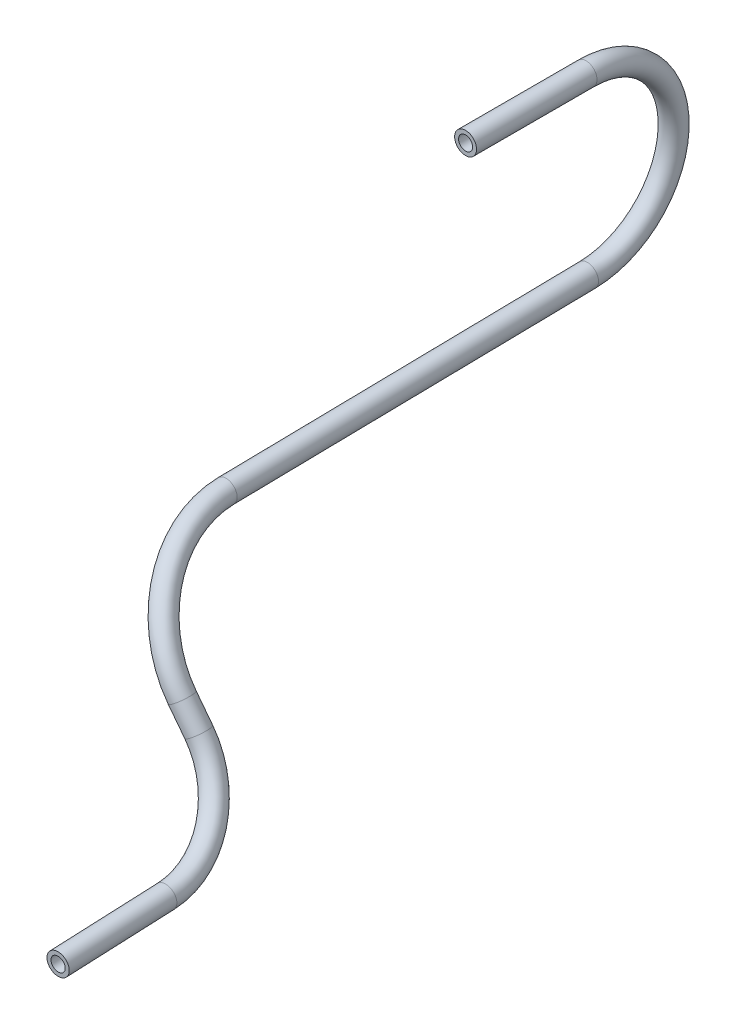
SolidWorks part; units mm, degrees
ref_plane "Front Plane" through (0, 0, 0) normal (0, 0, 1) x (1, 0, 0)
ref_plane "Top Plane" through (0, 0, 0) normal (0, 1, 0) x (1, 0, 0)
ref_plane "Right Plane" through (0, 0, 0) normal (1, 0, 0) x (0, 0, -1)
sketch "Sketch1" plane through (0, 0, 0) normal (1, 0, 0) x (0, 0, -1)
  line L3 (17.6841, -25.3981) -> (-34.6954, -26.3124)
  line L4 (17.4625, 0) -> (0, 0)
  arc A2 (17.6841, -25.3981) -> (17.4625, 0) centre (17.4625, -12.7) ccw
  dimension "D1" = 12.7
  dimension "D2" = 1
  dimension "D5" = 52.3875
  dimension "D7" = 17.4625
sketch "Sketch2" plane through (0, 0, 0) normal (0, 0, 1) x (1, 0, 0)
  circle A0 centre (0, 0) radius 1.5875
  circle A1 centre (0, 0) radius 1.016
  dimension "D1" = 3.175
  dimension "D2" = 2.032
sweep "Sweep2" add profiles "Sketch2" path "Sketch1"
ref_plane "Plane2" through (0, -25.6989, -0.4486) normal (0, -0.9998, -0.0175) x (-0.0175, 0.0174, -0.9997)
sketch "Sketch5" plane through (0, -0.6134, 35.144) normal (0, -0.0175, 0.9998) x (1, 0, 0)
  line L0 (1.2609, -44.1997) -> (21.3128, -30.1592) construction
  line L1 (0, -25.7028) -> (0, -13.3682) construction
  circle A0 centre (0, -25.7028) radius 1.016
  circle A1 centre (0, -25.7028) radius 1.5875
  dimension "D1" = 125
  dimension "D2" = 15.875
revolve "Revolve1" add sketch "Sketch5" angle 91 about L0
sketch "Sketch6" plane through (20.8237, -29.7237, -1.1526) normal (0.5735, -0.8186, -0.0317) x (0.6422, 0.4733, -0.603)
  circle A0 centre (-43.2456, 31.8791) radius 1.016 construction
  circle A1 centre (-43.2456, 31.8791) radius 1.5875
  circle A2 centre (-43.2456, 31.8791) radius 1.5875
  circle A3 centre (-43.2456, 31.8791) radius 1.016
  dimension "D1" = 0
extrude "Boss-Extrude1" add sketch "Sketch6" along normal blind 3.9687
sketch "Sketch7" plane through (23.0997, -32.9725, -1.2786) normal (0.5735, -0.8186, -0.0317) x (-0.0311, 0.0169, -0.9994)
  line L0 (-63.923, -18.6454) -> (-63.5841, -38.0587) construction
  line L1 (-51.266, -16.0702) -> (-51.266, -27.9924) construction
  circle A0 centre (-51.266, -16.0702) radius 1.016 construction
  circle A1 centre (-51.266, -16.0702) radius 1.5875
  circle A2 centre (-51.266, -16.0702) radius 1.5875
  circle A3 centre (-51.266, -16.0702) radius 1.016
  dimension "D2" = 1
  dimension "D3" = 12.7
  dimension "D1" = 0
revolve "Revolve2" add sketch "Sketch7" angle 90 about L0
sketch "Sketch8" plane through (1.082, -1.7318, 64.2062) normal (0.0168, -0.027, 0.9995) x (0.9999, 0.0004, -0.0168)
  circle A0 centre (17.9585, -52.101) radius 1.016 construction
  circle A1 centre (17.9585, -52.101) radius 1.5875
  circle A2 centre (17.9585, -52.101) radius 1.5875
  circle A3 centre (17.9585, -52.101) radius 1.016
  dimension "D1" = 0
extrude "Boss-Extrude2" add sketch "Sketch8" along normal blind 15.875
equation "\"Buoyancy\"=\"SW-Volume\"*(\"SW-Density\"-.037062)"
